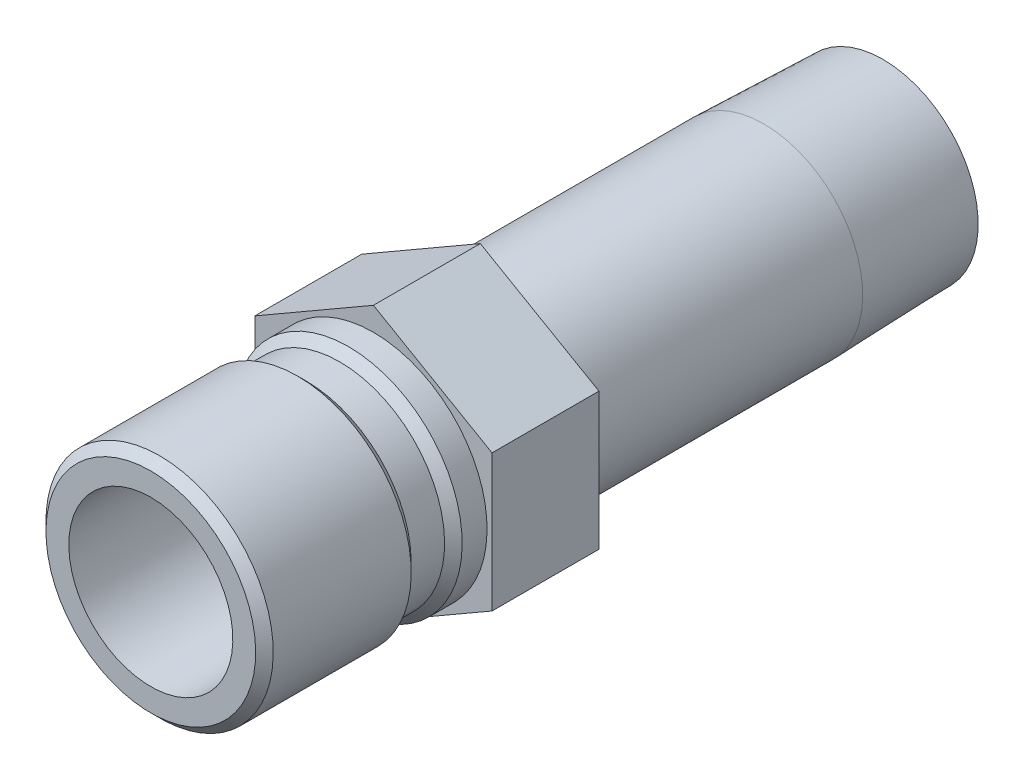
SolidWorks part; units mm, degrees
ref_plane "Front Plane" through (0, 0, 0) normal (0, 0, 1) x (1, 0, 0)
ref_plane "Top Plane" through (0, 0, 0) normal (0, 1, 0) x (1, 0, 0)
ref_plane "Right Plane" through (0, 0, 0) normal (1, 0, 0) x (0, 0, -1)
sketch "Sketch1" plane through (0, 0, 0) normal (1, 0, 0) x (0, 0, -1)
  line L0 (0, 0) -> (-22.479, 0) construction
  line L1 (-19.304, 7.112) -> (-19.304, 9.0932)
  line L2 (-5.8166, 9.0932) -> (-5.8166, 0) construction
  line L3 (-18.542, 9.8552) -> (-6.5786, 9.8552)
  line L4 (0, 8.5725) -> (0, 0) construction
  line L5 (-5.8166, 9.0932) -> (-2.921, 9.0932)
  line L6 (-2.159, 9.8552) -> (0, 9.8552)
  line L7 (0, 9.8552) -> (0, 8.5725)
  line L8 (-5.8166, 9.0932) -> (-6.5786, 9.8552)
  line L9 (-2.921, 9.0932) -> (-2.159, 9.8552)
  line L10 (-19.304, 9.0932) -> (-18.542, 9.8552)
  line L11 (-19.304, 7.112) -> (-1.524, 7.112)
  line L12 (0, 8.5725) -> (33.8582, 8.5725)
  line L13 (33.8582, 8.5725) -> (44.196, 8.2494)
  line L14 (44.196, 8.2494) -> (44.196, 6.2611)
  line L15 (0, 9.8552) -> (9.271, 9.8552) construction
  line L16 (9.271, 9.8552) -> (9.271, 0) construction
  line L17 (9.271, 0) -> (0, 0) construction
  line L18 (-1.0716, 6.2611) -> (-1.524, 7.112)
  line L19 (-1.0716, 6.2611) -> (44.196, 6.2611)
  dimension "D1" = 19.304
  dimension "D2" = 2.8956
  dimension "D3" = 0.762
  dimension "D4" = 45
  dimension "D5" = 13.4874
  dimension "D6" = 45
  dimension "D7" = 1.79
  dimension "D8" = 10.3378
  dimension "D9" = 63.5
  dimension "D10" = 3.175
  dimension "D11" = 28.575
  dimension "D12" = 14.224
  dimension "D13" = 17.145
  dimension "D14" = 19.7104
  dimension "D15" = 12.5222
  dimension "D16" = 118
  dimension "D17" = 17.78
revolve "Revolve1" add sketch "Sketch1" angle 360 about L0
sketch "Sketch2" plane through (0, 0, 0) normal (0, 0, 1) x (1, 0, 0)
  line L1 (-10.287, 5.9392) -> (-10.287, -5.9392)
  line L2 (-10.287, -5.9392) -> (0, -11.8784)
  line L3 (0, -11.8784) -> (10.287, -5.9392)
  line L4 (10.287, -5.9392) -> (10.287, 5.9392)
  line L5 (10.287, 5.9392) -> (0, 11.8784)
  line L6 (0, 11.8784) -> (-10.287, 5.9392)
  circle A0 centre (0, 0) radius 10.287 construction
  circle A1 centre (0, 0) radius 7.112 construction
  circle A2 centre (0, 0) radius 7.112
  dimension "D1" = 20.574
extrude "Boss-Extrude1" add sketch "Sketch2" against normal up to vertex (9.271 mm away) from vertex at 0
